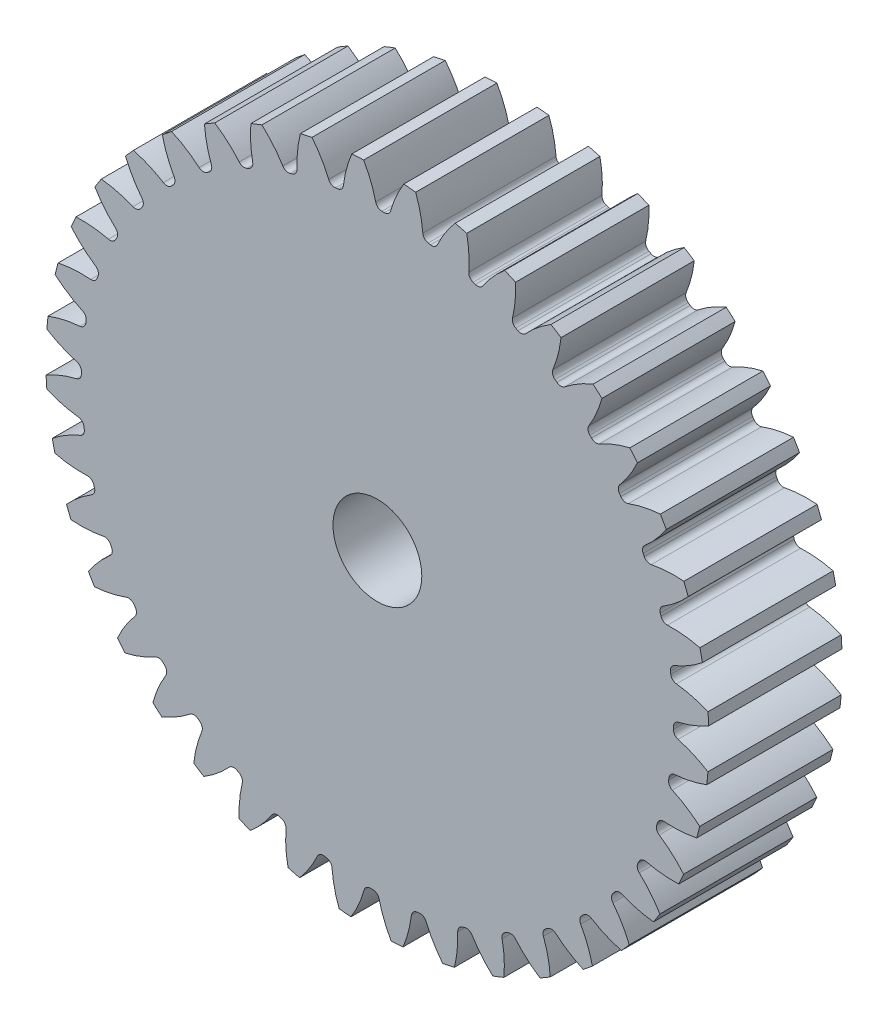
SolidWorks part; units mm, degrees
ref_plane "Front" through (0, 0, 0) normal (0, 0, 1) x (1, 0, 0)
ref_plane "Top" through (0, 0, 0) normal (0, 1, 0) x (1, 0, 0)
ref_plane "Right" through (0, 0, 0) normal (1, 0, 0) x (0, 0, -1)
sketch "Sketch3" plane through (0, 0, 0) normal (0, 0, 1) x (1, 0, 0)
  circle A0 centre (0, 0) radius 237.0667
  dimension "od" = 474.1333
extrude "gearBody" add sketch "Sketch3" along normal blind 95.25
sketch "Sketch2" plane through (0, 0, 0) normal (0, 0, 1) x (1, 0, 0)
  line L0 (0, 0) -> (196.0119, 81.1908) construction
  line L1 (236.5123, -19.0038) -> (0, 0) construction
  line L2 (0, 0) -> (36.3143, 0) construction
  line L3 (225.7328, 4.5082) -> (225.3944, -13.1515) construction
  line L5 (225.5636, -4.3217) -> (0, 0) construction
  line L7 (0, 0) -> (212.1617, 0) construction
  arc A0 (212.161, 0.5511) -> (211.9842, -8.6775) centre (0, 0) ccw construction
  arc A1 (236.8635, 9.8136) -> (236.3137, -18.8794) centre (0, 0) ccw construction
  arc A2 (225.7328, 4.5082) -> (225.3944, -13.1515) centre (0, 0) ccw construction
  arc A3 (211.6094, -4.922) -> (211.6427, -3.1873) centre (0, 0) ccw
  arc A4 (236.5123, -19.0038) -> (214.9623, -9.4527) centre (192.758, -88.6394) ccw
  arc A5 (236.5123, -19.0038) -> (237.0667, 9.9303) centre (0, 0) ccw
  arc A6 (237.0667, 9.9303) -> (215.1666, 1.2117) centre (196.0119, 81.1908) cw
  arc A7 (211.6427, -3.1873) -> (215.1666, 1.2117) centre (216.2367, -3.2565) cw
  arc A8 (214.9623, -9.4527) -> (211.6094, -4.922) centre (216.2028, -5.0288) cw
  point P6 (237.0667, 9.9303)
  point P22 (236.5123, -19.0038)
  dimension "baseDia" = 424.3234
  dimension "od" = 474.1333
  dimension "pd" = 451.5556
  dimension "rd" = 423.3333
  dimension "rFillet" = 4.5946
  dimension "pointX" = 237.0667
  dimension "pointY" = 9.9303
  dimension "CTT" = 17.6597
  dimension "flankCenterAngle" = 22.5
extrude "toothCut" cut sketch "Sketch2" along normal through all
pattern_circular "CirPattern1" count 40 over 360 about axis through (0, 0, 0) along (0, 0, 1) of "toothCut"
sketch "hub1Dia" plane through (0, 0, 0) normal (0, 0, -1) x (-1, 0, 0)
  circle A0 centre (0, 0) radius 12.7
  dimension "hub1Dia" = 25.4
sketch "hub2Dia" plane through (0, 0, 95.25) normal (0, 0, 1) x (1, 0, 0)
  circle A0 centre (0, 0) radius 12.7
  dimension "hub2dia" = 25.4
sketch "boreDia" plane through (0, 0, 0) normal (0, 0, 1) x (1, 0, 0)
  circle A0 centre (0, 0) radius 31.75
  dimension "boreDia" = 63.5
extrude "bore" cut sketch "boreDia" against normal mid plane 25400
